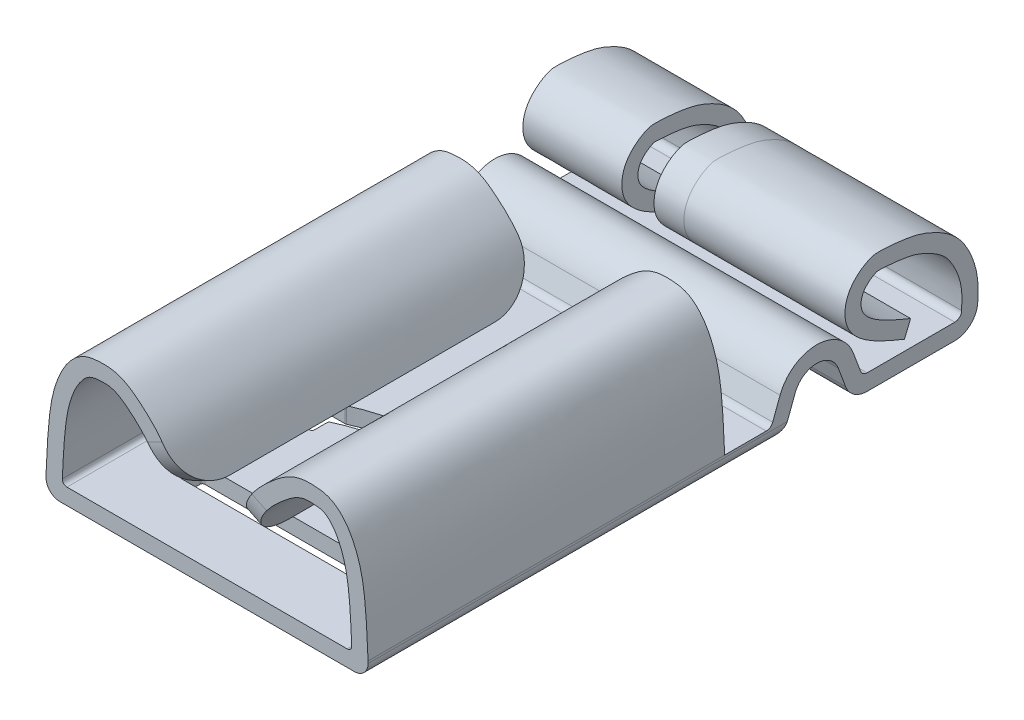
SolidWorks part; units mm, degrees
ref_plane "Plan de face" through (0, 0, 0) normal (0, 0, 1) x (1, 0, 0)
ref_plane "Plan de dessus" through (0, 0, 0) normal (0, 1, 0) x (1, 0, 0)
ref_plane "Plan de droite" through (0, 0, 0) normal (1, 0, 0) x (0, 0, -1)
sketch "Esquisse1" plane through (0, 0, 0) normal (0, 0, 1) x (1, 0, 0)
  line L0 (0.8144, 1.1962) -> (0.5, 1.35)
  line L1 (3.1503, 0.3345) -> (3.5, 0.35)
  spline S0 degree 3 poles (3.5, 0.35) (3.486, 0.666) (3.4563, 1.3377) (3.3237, 2.3302) (2.8476, 3.006) (2.0868, 3.0939) (1.8477, 3.0565) (1.1134, 2.448) (0.8722, 2.1106) (0.6098, 1.5744) (0.5, 1.35) knots 0 0 0 0 0.162898 0.346347 0.525763 0.525763 0.704901 0.704901 0.876545 1 1 1 1
  spline S1 degree 1 poles (3.1503, 0.3345) (0.8144, 1.1962) knots 0 0 1 1 construction
  spline S2 degree 3 poles (3.1503, 0.3345) (3.1398, 0.5737) (3.117, 1.0586) (3.068, 1.6299) (2.9698, 2.0378) (2.8478, 2.342) (2.6762, 2.588) (2.5385, 2.6825) (2.4086, 2.7069) (2.1783, 2.7217) (2.0403, 2.6971) (1.8545, 2.6078) (1.6128, 2.4082) (1.423, 2.2329) (1.2746, 2.0587) (1.0943, 1.7665) (0.9176, 1.4072) (0.8144, 1.1962) knots 0 0 0 0 0.125 0.25 0.3125 0.375 0.4375 0.5 0.53125 0.5625 0.625 0.6875 0.71875 0.75 0.8125 0.875 1 1 1 1
  dimension "D6" = 0.35
extrude "Extrusion1" add sketch "Esquisse1" along normal blind 7.75
sketch "Esquisse2" plane through (0, 0, 7.75) normal (0, 0, 1) x (1, 0, 0)
  line L0 (3.5, 0.35) -> (3.1525, 0.3348)
  line L1 (0, 0) -> (3.5, 0)
  line L2 (3.5, 0) -> (3.5, 0.35)
  line L3 (0, 0) -> (0, 0.35)
  line L4 (0, 0.35) -> (3.1525, 0.35)
  line L5 (3.1525, 0.35) -> (3.1525, 0.3348)
  dimension "D1" = 0.35
extrude "Extrusion2" add sketch "Esquisse2" against normal blind 7.75
sketch "Esquisse3" plane through (0, 0, 0) normal (0, 0, -1) x (-1, 0, 0)
  line L1 (0, 0.35) -> (-3.5, 0.35)
  line L2 (0, 0.35) -> (0, 0)
  line L3 (0, 0) -> (-3.5, 0)
  line L4 (-3.5, 0.35) -> (-3.5, 0)
sketch "Esquisse4" plane through (0, 0, 0) normal (1, 0, 0) x (0, 0, -1)
  line L0 (0, 0) -> (0.9035, 0)
  line L1 (1.3717, 0.3244) -> (1.5318, 0.7516)
  line L2 (2.4682, 0.7516) -> (2.6283, 0.3244)
  line L3 (3.0965, 0) -> (5.0016, 0)
  line L4 (0, 0.35) -> (0, 3.0651) construction
  arc A0 (0.9035, 0) -> (1.3717, 0.3244) centre (0.9035, 0.5) ccw
  arc A1 (2.6283, 0.3244) -> (3.0965, 0) centre (3.0965, 0.5) ccw
  arc A2 (1.5318, 0.7516) -> (2.4682, 0.7516) centre (2, 0.576) cw
  arc A3 (5.0016, 0) -> (5.5013, 0.4849) centre (5.0016, 0.5) ccw
  spline S0 degree 3 poles (5.5013, 0.4849) (5.5054, 0.6182) (5.5203, 0.9454) (5.3889, 1.4092) (5.138, 1.8577) (4.7607, 2.1828) (4.3949, 2.338) (3.9849, 2.4649) (3.5135, 2.5102) (3.1421, 2.4931) (2.6579, 2.2007) (2.5087, 1.1552) (3.3161, 0.8209) (3.9075, 0.576) knots 0.071519 0.071519 0.071519 0.071519 0.130402 0.215742 0.28108 0.354179 0.437269 0.437269 0.578573 0.578573 0.674371 0.761509 1 1 1 1
  point P9 (1.25, 0)
  point P12 (2.75, 0)
  point P15 (2, 2)
  dimension "D6" = 0.5
  dimension "D7" = 0.5
  dimension "D8" = 0.5
  dimension "D1" = 0.5
  dimension "D2" = 2
  dimension "D3" = 2
  dimension "D4" = 1.25
  dimension "D5" = 1.5
  dimension "D9" = 2.5
sweep "Balayage1" add profiles "Esquisse3" path "Esquisse4"
fillet "Congé1" radius 1 2 edges at (0.6572, 1.2731, 7.75) (0.6572, 1.2731, 0)
mirror "Symétrie6" about plane through (0, 0, 0) normal (1, 0, 0) of "Extrusion2", "Extrusion1"
mirror "Symétrie7" about plane through (0, 0, 0) normal (1, 0, 0) of "Congé1", "Extrusion1"
mirror "Symétrie8" about plane through (0, 0, 0) normal (1, 0, 0) of "Balayage1"
ref_plane "Plan1" through (-1, 0, 0) normal (-1, 0, 0) x (0, 0, 1)
sketch "Esquisse5" plane through (-1, 0, 0) normal (-1, 0, 0) x (0, 0, 1)
  line L1 (-3.0965, 0.35) -> (-5.0016, 0.35) construction
  line L2 (-5.956, 0.35) -> (-5.956, 2.1337)
  line L3 (-5.956, 2.1337) -> (-3.8452, 2.6614)
  line L4 (-4.5719, 0.35) -> (-3.2848, 0.6948)
  line L5 (-4.5719, 0.35) -> (-4.5719, -0.1522)
  line L6 (-4.5719, -0.1522) -> (-5.956, -0.1522)
  line L7 (-5.956, -0.1522) -> (-5.956, 0.35)
  arc A0 (-3.2848, 0.6948) -> (-3.8452, 2.6614) centre (-3.5494, 1.6825) ccw
extrude "Enlèv. mat.-Extru.1" cut sketch "Esquisse5" against normal mid plane 0.7
fillet "Congé2" radius 0.3 2 edges at (-3.5, 0, 3.4233) (3.5, 0, 3.4233)
fillet "Congé3" radius 0.1 2 edges at (-3.1497, 0.35, 3.875)
sketch "Esquisse6" plane through (0, 0, 0) normal (0, -1, 0) x (1, 0, 0)
  line L0 (2, 3.235) -> (2, 3.9848)
  line L1 (1.95, 6.3491) -> (-1.95, 6.3491)
  line L2 (2, 6.2991) -> (2, 5.8991)
  line L3 (1.95, 5.8491) -> (-1.95, 5.8491)
  line L4 (-2, 6.2991) -> (-2, 5.8991)
  line L5 (1.95, 3.185) -> (1.5642, 3.185)
  line L6 (1.95, 4.0348) -> (1.4821, 4.0348)
  line L7 (1.4321, 3.9848) -> (1.4321, 3.7119)
  line L8 (0, 3.3491) -> (0, 2.5328) construction
  line L9 (-1.4321, 3.9848) -> (-1.4321, 3.7119)
  line L10 (-1.95, 4.0348) -> (-1.4821, 4.0348)
  line L11 (-1.95, 3.185) -> (-1.5642, 3.185)
  line L12 (-2, 3.235) -> (-2, 3.9848)
  arc A0 (1.95, 6.3491) -> (2, 6.2991) centre (1.95, 6.2991) cw
  arc A1 (2, 5.8991) -> (1.95, 5.8491) centre (1.95, 5.8991) cw
  arc A2 (-1.95, 6.3491) -> (-2, 6.2991) centre (-1.95, 6.2991) ccw
  arc A3 (-1.95, 5.8491) -> (-2, 5.8991) centre (-1.95, 5.8991) cw
  arc A4 (-1.4036, 3.6668) -> (1.4036, 3.6668) centre (0, 6.6087) ccw
  arc A5 (-1.5436, 3.1806) -> (1.5436, 3.1806) centre (0, 6.6087) ccw
  arc A6 (2, 3.235) -> (1.95, 3.185) centre (1.95, 3.235) cw
  arc A7 (2, 3.9848) -> (1.95, 4.0348) centre (1.95, 3.9848) ccw
  arc A8 (1.4821, 4.0348) -> (1.4321, 3.9848) centre (1.4821, 3.9848) ccw
  arc A9 (1.4321, 3.7119) -> (1.4036, 3.6668) centre (1.3821, 3.7119) cw
  arc A10 (1.5436, 3.1806) -> (1.5642, 3.185) centre (1.5642, 3.135) cw
  arc A11 (-1.4321, 3.7119) -> (-1.4036, 3.6668) centre (-1.3821, 3.7119) ccw
  arc A12 (-1.4321, 3.9848) -> (-1.4821, 4.0348) centre (-1.4821, 3.9848) ccw
  arc A13 (-1.95, 4.0348) -> (-2, 3.9848) centre (-1.95, 3.9848) ccw
  arc A14 (-1.95, 3.185) -> (-2, 3.235) centre (-1.95, 3.235) cw
  arc A15 (-1.5642, 3.185) -> (-1.5436, 3.1806) centre (-1.5642, 3.135) cw
  point P7 (2, 6.3491)
  point P10 (2, 5.8491)
  point P13 (-2, 6.3491)
  point P18 (0, 3.3491)
  point P20 (0, 2.8491)
  point P33 (2, 3.185)
  point P36 (2, 4.0348)
  point P39 (1.4321, 4.0348)
  point P42 (1.4321, 3.6805)
  point P45 (1.5534, 3.185)
  point P48 (-1.4321, 3.6805)
  point P51 (-1.4321, 4.0348)
  point P54 (-2, 4.0348)
  point P57 (-2, 3.185)
  point P60 (-1.5534, 3.185)
  dimension "D4" = 0.05
  dimension "D8" = 0.05
  dimension "D9" = 3.2596
  dimension "D1" = 0.5
  dimension "D2" = 2
  dimension "D3" = 4
  dimension "D5" = 3
  dimension "D6" = 0.5
  dimension "D7" = 2
extrude "Enlèv. mat.-Extru.2" cut sketch "Esquisse6" against normal blind 1
